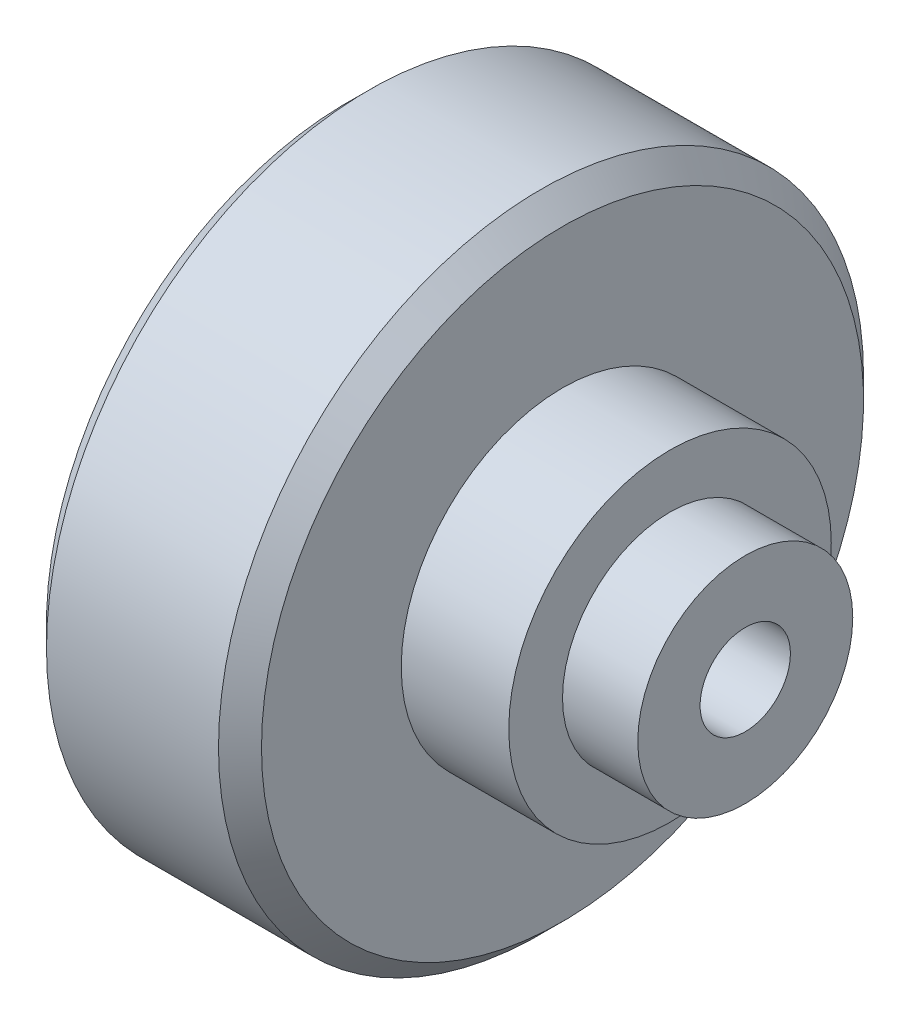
SolidWorks part; units mm, degrees
ref_plane "Front" through (0, 0, 0) normal (0, 0, 1) x (1, 0, 0)
ref_plane "Top" through (0, 0, 0) normal (0, 1, 0) x (1, 0, 0)
ref_plane "Right" through (0, 0, 0) normal (1, 0, 0) x (0, 0, -1)
sketch "Sketch1" plane through (0, 0, 0) normal (0, 1, 0) x (1, 0, 0)
  line L0 (0, 0) -> (18.5, 0)
  line L1 (18.5, 0) -> (18.5, 5)
  line L2 (18.5, 5) -> (15, 5)
  line L3 (15, 5) -> (15, 7.5)
  line L4 (15, 7.5) -> (10, 7.5)
  line L5 (10, 7.5) -> (10, 15)
  line L6 (10, 15) -> (0, 15)
  line L7 (0, 15) -> (0, 0)
revolve "Revolve1" add sketch "Sketch1" angle 360 about L0
chamfer "Chamfer1" distance 1 angle 45 2 edges at (0, 0, 15) (10, 0, 15)
hole_wizard "M5 Tapped Hole1" positions "3DSketch1" profile "Sketch2" tap size "M5" standard "ISO"
sketch3d "3DSketch1"
  line L0 (18.5, 0, 0) -> (15, 0, 0) construction
  point P0 (18.5, 0, 0)
sketch "Sketch2" plane through (18.5, 0, 0) normal (0, 1, 0) x (0, 0, -1)
  line L0 (0, 0) -> (0, 19.7618)
  line L1 (0, 19.7618) -> (2.1, 18.5)
  line L2 (2.1, 18.5) -> (2.1, 0)
  line L5 (2.1, 0) -> (0, 0)
  line L10 (0, 19.7618) -> (-2.1, 18.5) construction
  line L11 (0, -6.35) -> (0, 107.95) construction
  dimension "Tap Drill Dia." = 4.2
  dimension "Tap Drill Depth" = 18.5
  dimension "Drill Angle" = 118
